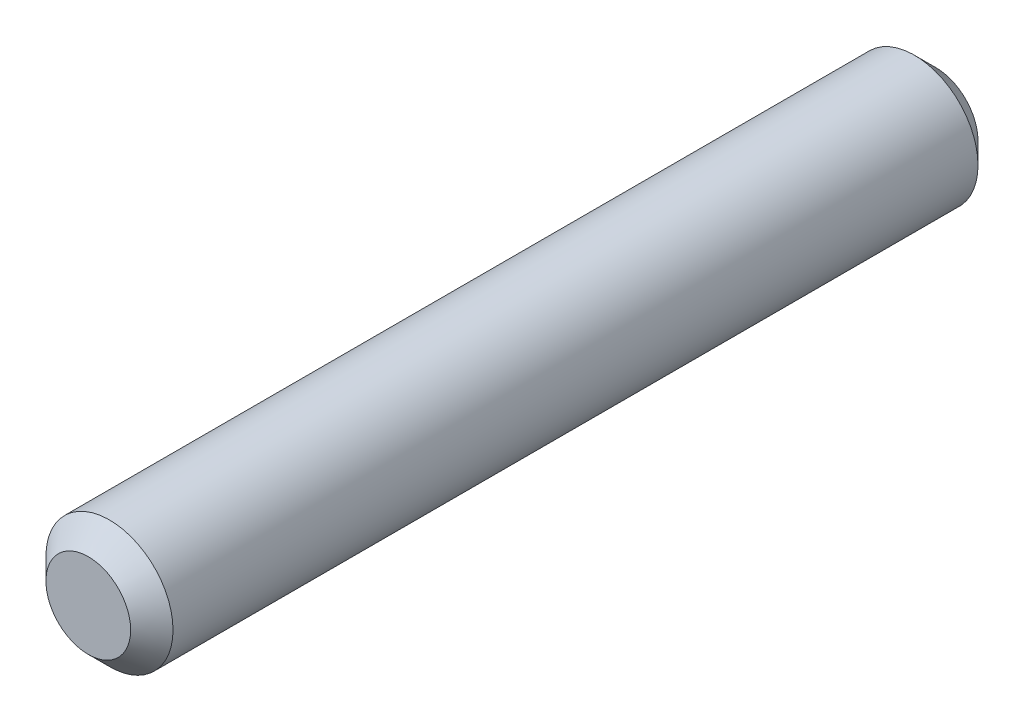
SolidWorks part; units mm, degrees
ref_plane "Спереди" through (0, 0, 0) normal (0, 0, 1) x (1, 0, 0)
ref_plane "Сверху" through (0, 0, 0) normal (0, 1, 0) x (1, 0, 0)
ref_plane "Справа" through (0, 0, 0) normal (1, 0, 0) x (0, 0, -1)
sketch "Эскиз2" plane through (0, 0, 0) normal (0, 0, 1) x (1, 0, 0)
  circle A0 centre (0, 0) radius 0.75
  dimension "D1" = 1.5
extrude "Бобышка-Вытянуть1" add sketch "Эскиз2" along normal mid plane 10
chamfer "Фаска1" distance 0.25 angle 45 2 edges at (0.75, 0, -5) (0.75, 0, 5)
